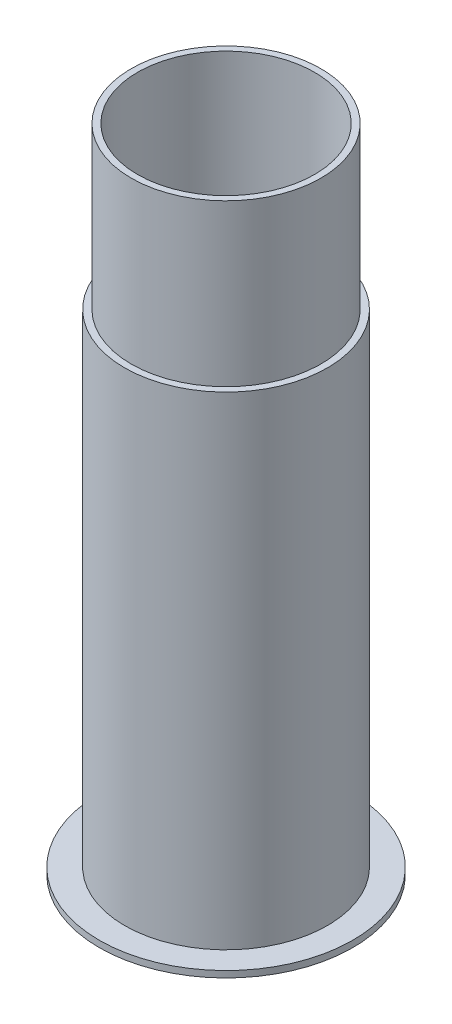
SolidWorks part; units mm, degrees
ref_plane "Front Plane" through (0, 0, 0) normal (0, 0, 1) x (1, 0, 0)
ref_plane "Top Plane" through (0, 0, 0) normal (0, 1, 0) x (1, 0, 0)
ref_plane "Right Plane" through (0, 0, 0) normal (1, 0, 0) x (0, 0, -1)
sketch "Sketch1" plane through (0, 0, 0) normal (0, 1, 0) x (1, 0, 0)
  circle A0 centre (0, 0) radius 5
  dimension "D1" = 10
extrude "Extrude1" add sketch "Sketch1" along normal blind 0.254
sketch "Sketch2" plane through (0, 0.254, 0) normal (0, 1, 0) x (1, 0, 0)
  circle A0 centre (0, 0) radius 4
  dimension "D1" = 8
extrude "Extrude2" add sketch "Sketch2" along normal blind 19.05
sketch "Sketch14" plane through (0, 19.304, 0) normal (0, 1, 0) x (-1, 0, 0)
  circle A0 centre (0, 0) radius 3.741
  dimension "D1" = 7.482
extrude "Extrude5" add sketch "Sketch14" along normal blind 6.35
sketch "Sketch15" plane through (0, 25.654, 0) normal (0, 1, 0) x (1, 0, 0)
  circle A0 centre (0, 0) radius 3.4925
  dimension "D1" = 6.985
extrude "Extrude6" cut sketch "Sketch15" against normal through all
sketch "Sketch16" plane through (0, 25.654, 0) normal (0, 1, 0) x (1, 0, 0)
  circle A0 centre (0, 0) radius 3.746
  dimension "D1" = 7.492
curve "Helix/Spiral2"
